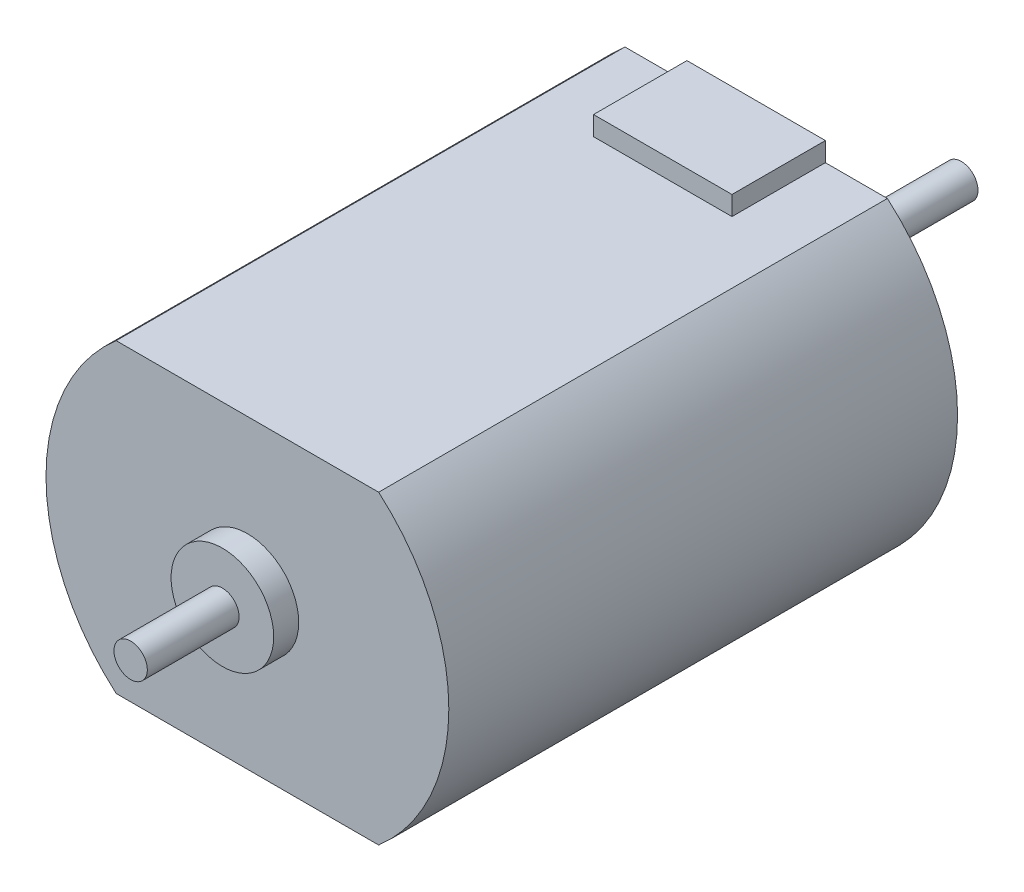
SolidWorks part; units mm, degrees
ref_plane "Front Plane" through (0, 0, 0) normal (0, 0, 1) x (1, 0, 0)
ref_plane "Top Plane" through (0, 0, 0) normal (0, 1, 0) x (1, 0, 0)
ref_plane "Right Plane" through (0, 0, 0) normal (1, 0, 0) x (0, 0, -1)
sketch "Sketch1" plane through (0, 0, 0) normal (0, 0, 1) x (1, 0, 0)
  line L1 (-7.8677, -9.16) -> (7.8677, -9.16)
  line L3 (-7.8677, 9.16) -> (7.8677, 9.16)
  line L5 (-7.8677, -9.16) -> (7.8677, 9.16) construction
  line L6 (-7.8677, 9.16) -> (7.8677, -9.16) construction
  arc A0 (-7.8677, 9.16) -> (-7.8677, -9.16) centre (0, 0) ccw
  arc A1 (7.8677, -9.16) -> (7.8677, 9.16) centre (0, 0) ccw
  point P0 (0, 0)
  dimension "D2" = 24.15
  dimension "D1" = 18.32
extrude "Main Body" add sketch "Sketch1" along normal blind 30.5
sketch "Sketch2" plane through (0, 0, 0) normal (0, 0, -1) x (-1, 0, 0)
  circle A0 centre (0, 0) radius 4.23
  dimension "D1" = 8.46
extrude "Long Shaft Collar" add sketch "Sketch2" along normal blind 2
sketch "Sketch3" plane through (0, 0, -2) normal (0, 0, -1) x (-1, 0, 0)
  circle A0 centre (0, 0) radius 1
  dimension "D1" = 2
extrude "Long Shaft" add sketch "Sketch3" along normal blind 10.3
sketch "Sketch5" plane through (0, 9.16, 0) normal (0, 1, 0) x (1, 0, 0)
  line L0 (7.8677, 0) -> (-7.8677, 0) construction
  line L2 (-4.15, 0) -> (4.15, 0)
  line L3 (-4.15, 0) -> (-4.15, -5.6)
  line L4 (-4.15, -5.6) -> (4.15, -5.6)
  line L5 (4.15, 0) -> (4.15, -5.6)
  point P6 (0, 0)
  dimension "D1" = 8.3
  dimension "D2" = 5.6
extrude "Lead Bump" add sketch "Sketch5" along normal blind 1.15
sketch "Sketch6" plane through (0, 0, 30.5) normal (0, 0, 1) x (1, 0, 0)
  circle A0 centre (0, 0) radius 3.075
  dimension "D1" = 6.15
extrude "Short Shaft Collar" add sketch "Sketch6" along normal blind 1.5
sketch "Sketch7" plane through (0, 0, 32) normal (0, 0, 1) x (1, 0, 0)
  circle A0 centre (0, 0) radius 1
  dimension "D1" = 2
extrude "Short shaft" add sketch "Sketch7" along normal blind 5.5
